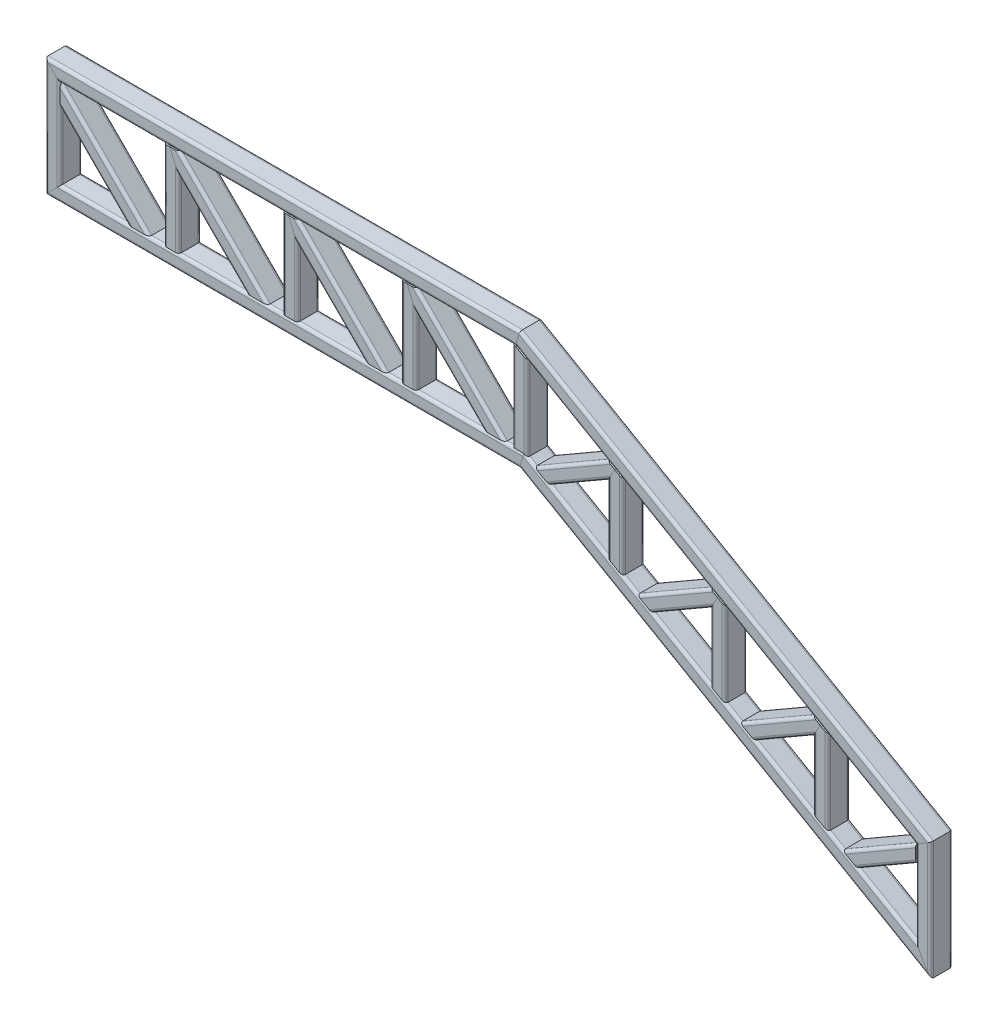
SolidWorks part; units mm, degrees
ref_plane "Front Plane" through (0, 0, 0) normal (0, 0, 1) x (1, 0, 0)
ref_plane "Top Plane" through (0, 0, 0) normal (0, 1, 0) x (1, 0, 0)
ref_plane "Right Plane" through (0, 0, 0) normal (1, 0, 0) x (0, 0, -1)
sketch "Sketch2"
  dimension "D1" = 2540
  dimension "D2" = 635
  dimension "D3" = 150
  dimension "D4" = 635
  dimension "D5" = 635
  dimension "D6" = 635
  dimension "D7" = 635
other "Structural Member4"
ref_plane "Plane10" through (0, 0, 0) normal (1, 0, 0) x (0, 1, 0)
sketch "Sketch14"
  dimension "D1" = 16
  dimension "D2" = 4.7625
  dimension "D3" = 6.604
  dimension "D4" = 41.275
  dimension "D5" = 41.275
  dimension "D6" = 4.7625
  dimension "D7" = 6.35
  dimension "D8" = 6.35
  dimension "Thickness" = 8
  dimension "V_leg" = 120
  dimension "H_leg" = 80
